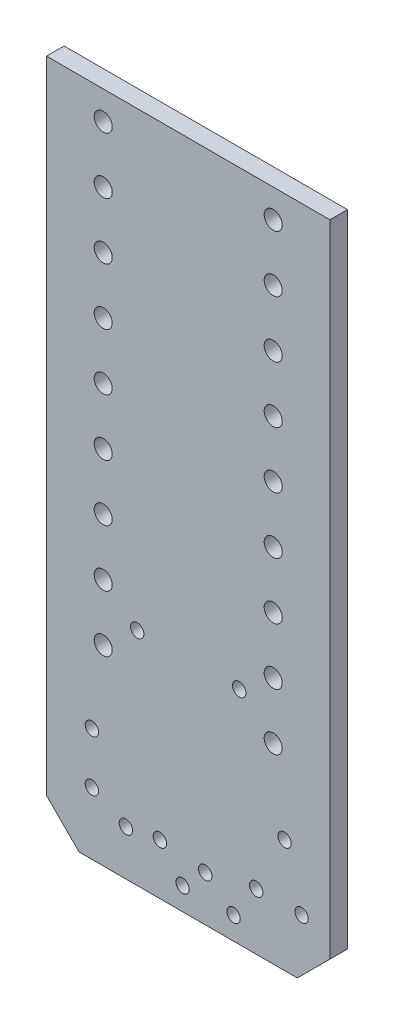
SolidWorks part; units mm, degrees
ref_plane "Front Plane" through (0, 0, 0) normal (0, 0, 1) x (1, 0, 0)
ref_plane "Top Plane" through (0, 0, 0) normal (0, 1, 0) x (1, 0, 0)
ref_plane "Right Plane" through (0, 0, 0) normal (1, 0, 0) x (0, 0, -1)
ref_plane "Dielectric_Layer Layer 1" through (0, 0, 0.7874) normal (0, 0, 1) x (1, 0, 0)
sketch "Sketch1" plane through (0, 0, 0) normal (0, 0, 1) x (1, 0, 0)
  line L0 (0, 1.4605) -> (0, 30.1625)
  line L1 (0, 30.1625) -> (12.7, 30.1625)
  line L2 (12.7, 30.1625) -> (12.7, 1.4605)
  line L3 (12.7, 1.4605) -> (11.2395, 0)
  line L4 (11.2395, 0) -> (1.4605, 0)
  line L5 (1.4605, 0) -> (0, 1.4605)
extrude "Board_Outline" add sketch "Sketch1" along normal blind 0.7874 separate body
sketch "Sketch2" plane through (0, 0, 0) normal (0, 0, 1) x (1, 0, 0)
  circle A0 centre (2.032, 5.08) radius 0.3
  circle A1 centre (6.096, 1.016) radius 0.3
  circle A2 centre (5.08, 2.286) radius 0.3
  circle A3 centre (3.556, 2.032) radius 0.3
  circle A4 centre (2.032, 2.794) radius 0.3
  circle A5 centre (4.064, 9.906) radius 0.3
  circle A6 centre (8.636, 9.906) radius 0.3
  circle A7 centre (11.43, 2.54) radius 0.3
  circle A8 centre (9.398, 2.54) radius 0.3
  circle A9 centre (8.382, 1.016) radius 0.3
  circle A10 centre (7.112, 2.032) radius 0.3
  circle A11 centre (10.668, 5.08) radius 0.3
extrude "NPTH" cut sketch "Sketch2" along normal through all
sketch "Sketch3" plane through (0, 0, 0) normal (0, 0, 1) x (1, 0, 0)
  circle A0 centre (2.54, 8.57) radius 0.405
  circle A1 centre (10.16, 8.57) radius 0.405
  circle A2 centre (2.54, 28.89) radius 0.405
  circle A3 centre (2.54, 26.35) radius 0.405
  circle A4 centre (2.54, 23.81) radius 0.405
  circle A5 centre (2.54, 21.27) radius 0.405
  circle A6 centre (2.54, 18.73) radius 0.405
  circle A7 centre (2.54, 16.19) radius 0.405
  circle A8 centre (2.54, 13.65) radius 0.405
  circle A9 centre (2.54, 11.11) radius 0.405
  circle A10 centre (10.16, 11.11) radius 0.405
  circle A11 centre (10.16, 13.65) radius 0.405
  circle A12 centre (10.16, 16.19) radius 0.405
  circle A13 centre (10.16, 18.73) radius 0.405
  circle A14 centre (10.16, 21.27) radius 0.405
  circle A15 centre (10.16, 23.81) radius 0.405
  circle A16 centre (10.16, 26.35) radius 0.405
  circle A17 centre (10.16, 28.89) radius 0.405
extrude "PTH" cut sketch "Sketch3" along normal through all
